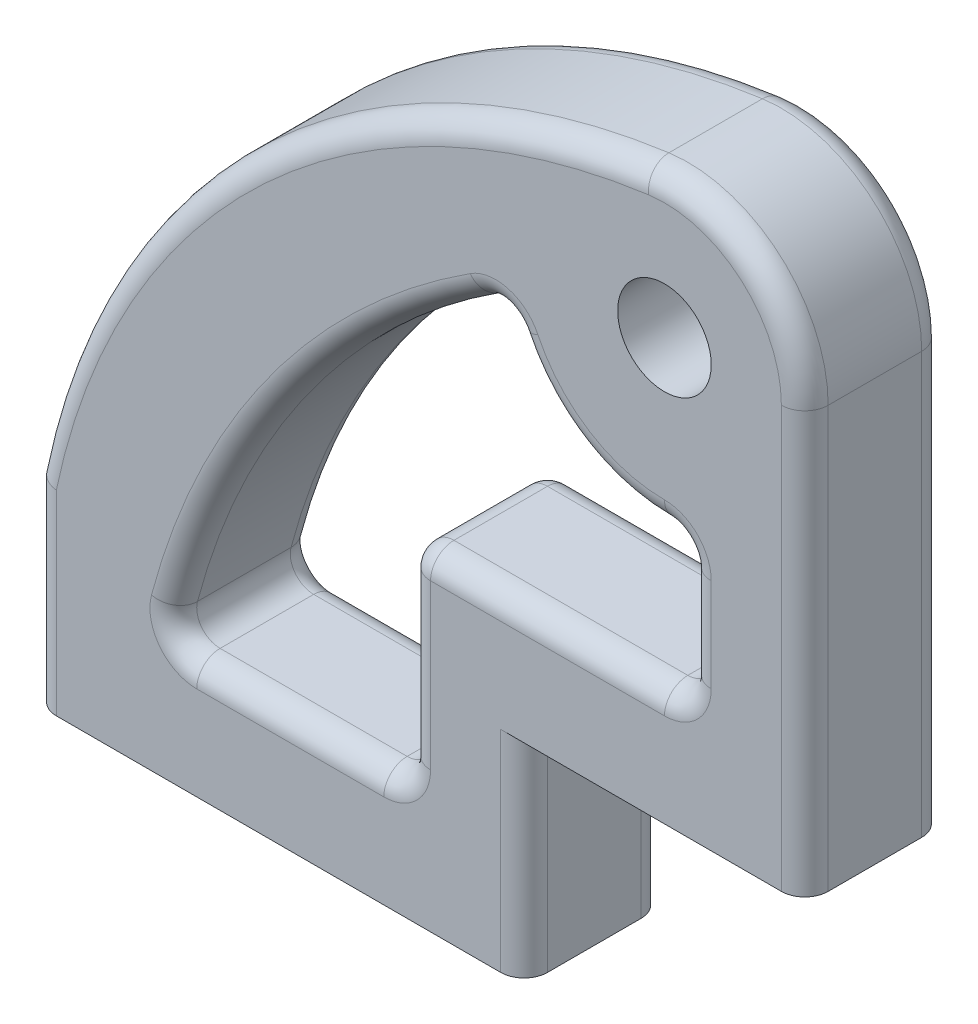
SolidWorks part; units mm, degrees
ref_plane "Front Plane" through (0, 0, 0) normal (0, 0, 1) x (1, 0, 0)
ref_plane "Top Plane" through (0, 0, 0) normal (0, 1, 0) x (1, 0, 0)
ref_plane "Right Plane" through (0, 0, 0) normal (1, 0, 0) x (0, 0, -1)
sketch "Sketch1" plane through (0, 0, 0) normal (0, 0, 1) x (1, 0, 0)
  line L0 (0, 0) -> (42, 0)
  line L1 (42, 0) -> (42, 18)
  line L2 (42, 18) -> (66, 18)
  line L3 (66, 18) -> (66, 54)
  line L4 (54, 28) -> (34, 28)
  line L5 (32, 26) -> (32, 12)
  line L6 (30, 10) -> (14.0062, 10)
  line L7 (56, 30) -> (56, 38)
  line L8 (0, 0) -> (0, 16.9183)
  arc A0 (66, 54) -> (52.3837, 65.8907) centre (54, 54) ccw
  arc A1 (41.3715, 47.9567) -> (54, 40) centre (54, 54) ccw
  circle A2 centre (54, 54) radius 4
  arc A3 (52.3837, 65.8907) -> (0, 16.9183) centre (60.7345, 4.4556) ccw
  arc A6 (38.4864, 48.776) -> (12.0731, 12.5129) centre (72, -3.3856) ccw
  arc A7 (12.0731, 12.5129) -> (14.0062, 10) centre (14.0062, 12) ccw
  arc A8 (32, 12) -> (30, 10) centre (30, 12) cw
  arc A9 (34, 28) -> (32, 26) centre (34, 26) ccw
  arc A10 (56, 30) -> (54, 28) centre (54, 30) cw
  arc A11 (56, 38) -> (54, 40) centre (54, 38) ccw
  arc A12 (41.3715, 47.9567) -> (38.4864, 48.776) centre (39.5674, 47.0934) ccw
  point P12 (97.9129, -10.2717)
  point P23 (32, 10)
  dimension "D11" = 8
  dimension "D17" = 2
  dimension "D1" = 24
  dimension "D2" = 18
  dimension "D3" = 42
  dimension "D4" = 10
  dimension "D5" = 10
  dimension "D6" = 10
  dimension "D16" = 44
extrude "Boss-Extrude1" add sketch "Sketch1" along normal blind 12
sketch "Sketch2" plane through (0, 0, 0) normal (0, -1, 0) x (1, 0, 0)
  line L0 (0, 6) -> (64, 6) construction
  line L1 (0, 12) -> (0, 0) construction
  line L2 (54, 12) -> (54, 6) construction
  line L3 (42, 12) -> (66, 12) construction
  line L4 (54, 6) -> (32, 6) construction
  line L5 (32, 6) -> (32, 12) construction
  line L6 (0, 12) -> (42, 12) construction
  line L7 (32, 12) -> (32, 6) construction
  line L8 (32, 6) -> (10, 6) construction
  line L9 (10, 6) -> (10, 12) construction
  line L10 (66, 12) -> (66, 0) construction
  dimension "D1" = 12
  dimension "D2" = 22
  dimension "D3" = 22
fillet "Fillet1" radius 2 33 edges at (55.4142, 39.4142, 0) (56, 34, 0) (55.4142, 28.5858, 0) (44, 28, 0) (32.5858, 27.4142, 0) (32, 19, 0) (31.4142, 10.5858, 0) (22.0031, 10, 0) (12.421, 10.7805, 0) (21.8847, 33.1173, 0) (40.1138, 49.0173, 0) (66, 36, 0) (61.8932, 63.0387, 0) (66, 36, 12) (61.8932, 63.0387, 12) (40.1138, 49.0173, 12) (46.537, 42.155, 12) (55.4142, 39.4142, 12) (56, 34, 12) (55.4142, 28.5858, 12) (44, 28, 12) (32.5858, 27.4142, 12) (32, 19, 12) (31.4142, 10.5858, 12) (22.0031, 10, 12) (12.421, 10.7805, 12) (42, 9, 0) (46.537, 42.155, 0) (18.3934, 49.7461, 0) (42, 9, 12) (18.3934, 49.7461, 12) (0, 8.4591, 12) (21.8847, 33.1173, 12)
sketch "Sketch3" plane through (0, 18, 0) normal (0, -1, 0) x (1, 0, 0)
  line L0 (54, 6) -> (66, 6) construction
  line L1 (66, 10) -> (66, 2) construction
  line L2 (66, 6) -> (54, 6) construction
  line L3 (54, 6) -> (54.4323, 12) construction
  line L4 (40, 12) -> (64, 12) construction
hole_wizard "M6 Tapped Hole4" positions "3DSketch3" profile "Sketch5" tap size "M6" standard "ISO"
sketch3d "3DSketch3"
  point P0 (10, 0, 6)
  point P3 (32, 0, 6)
  point P6 (54, 18, 6)
sketch "Sketch5" plane through (10, 0, 6) normal (1, 0, 0) x (0, 0, -1)
  line L0 (0, 0) -> (0, 9.5)
  line L1 (0, 9.5) -> (2.5, 9.5)
  line L2 (2.5, 9.5) -> (2.5, 0)
  line L5 (2.5, 0) -> (0, 0)
  line L10 (0, 9.5) -> (-2.5, 9.5) construction
  line L11 (0, -6.35) -> (0, 107.95) construction
  dimension "Tap Drill Dia." = 5
  dimension "Tap Drill Depth" = 9.5
  dimension "Drill Angle" = 180
sketch "Sketch6" plane through (0, 0, 12) normal (0, 0, 1) x (1, 0, 0)
  text T0 "S1067869  "
